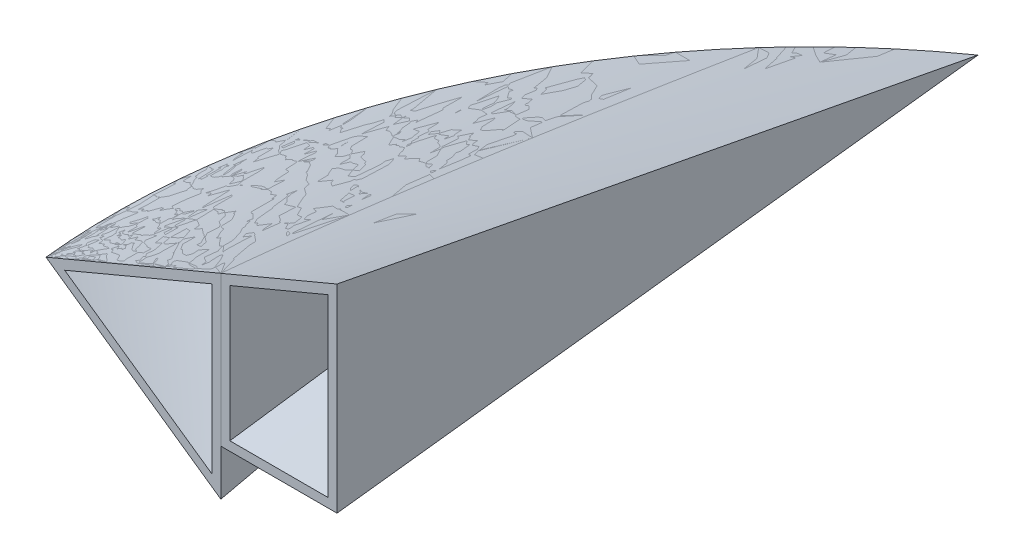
SolidWorks part; units mm, degrees
ref_plane "Ebene vorne" through (0, 0, 0) normal (0, 0, 1) x (1, 0, 0)
ref_plane "Ebene oben" through (0, 0, 0) normal (0, 1, 0) x (1, 0, 0)
ref_plane "Ebene rechts" through (0, 0, 0) normal (1, 0, 0) x (0, 0, -1)
sketch "Skizze1" plane through (0, 0, 0) normal (0, 0, 1) x (1, 0, 0)
  line L0 (0, 26.9971) -> (-64.2741, 0)
  line L2 (-64.2741, 0) -> (-25.658, -26.9891)
  line L4 (-25.658, -26.9891) -> (-25.658, -16.8383)
  line L5 (-25.658, -16.8383) -> (0, -16.8383)
sketch "Skizze2" plane through (0, 0, 0) normal (1, 0, 0) x (0, 0, -1)
  line L0 (0, 26.9971) -> (141.5806, 0)
sketch "Skizze3" plane through (0, 0, 0) normal (0, 1, 0) x (1, 0, 0)
  line L0 (0, 0) -> (0, 141.5806) construction
  arc A0 (-64.2741, 0) -> (0, 141.5806) centre (88.6698, 15.9469) cw
sketch "Skizze5" plane through (0, 0, 0) normal (0, 0, 1) x (1, 0, 0)
  line L0 (0, 26.9971) -> (-64.2741, 0) construction
  line L1 (0, 26.9971) -> (-64.2741, 0)
surface "Oberfläche-Ausformung1"
sketch "Skizze6" plane through (0, 0, 0) normal (0, 0, 1) x (1, 0, 0)
  line L0 (-25.658, -26.9891) -> (-25.658, -16.8383) construction
  line L1 (-25.658, -26.9891) -> (-25.658, 24.9515)
surface "Oberfläche-Linear austragen1" sketch "Skizze6" parameters "D1"=136
sketch "Skizze7" plane through (-25.658, 0, 0) normal (-1, 0, 0) x (0, 0, 1)
  line L1 (-118.7871, 0) -> (0, -26.9891)
  point P3 (0, 16.22)
other "Fläche löschen1"
sketch3d "3D-Skizze3"
  point P0 (-25.658, 0, -118.7871)
  point P2 (-64.2741, 0, 0)
  point P3 (0, 0, -141.5806)
surface "Oberfläche-Ausformung2"
sketch "Skizze8" plane through (0, 0, 0) normal (0, 0, 1) x (1, 0, 0)
  line L0 (0, 26.9971) -> (-64.2741, 0) construction
  line L1 (-25.658, 16.22) -> (-64.2741, 0)
  line L2 (-25.658, -26.9891) -> (-25.658, 16.22) construction
  line L3 (-25.658, -26.9891) -> (-25.658, 16.22)
  line L4 (-64.2741, 0) -> (-25.658, -26.9891) construction
  line L5 (-64.2741, 0) -> (-25.658, -26.9891)
surface "Oberfläche-Ebene1" sketch "Skizze8"
sketch "Skizze9" plane through (0, 0, 0) normal (0, 1, 0) x (1, 0, 0)
  line L0 (-25.658, 0) -> (-25.658, 118.7871) construction
  line L1 (-25.658, 0) -> (-25.658, 118.7871)
surface "Oberfläche-Zusammenfügen1"
sketch3d "3D-Skizze4"
  line L0 (0, -16.8383, 0) -> (0, 0, -141.5806)
sketch "Skizze10" plane through (-25.658, 0, 0) normal (1, 0, 0) x (0, 0, -1)
  line L0 (0, -16.8383) -> (118.7871, 0)
surface "Oberfläche-Ausformung3"
surface "Oberfläche-Ausformung4"
sketch3d "3D-Skizze5"
  point P0 (-25.658, 0, -118.7871)
  point P1 (0, 0, -141.5806)
sketch "Skizze11" plane through (0, 0, 0) normal (0, 0, 1) x (1, 0, 0)
  line L0 (-25.658, -16.8383) -> (0, -16.8383) construction
  line L1 (-25.658, -16.8383) -> (0, -16.8383)
surface "Oberfläche-Ausformung5"
surface "Oberflächenausfüllung1"
surface "Oberfläche-Zusammenfügen2"
shell "Wandung1" thickness 2
shell "Wandung2" thickness 2
